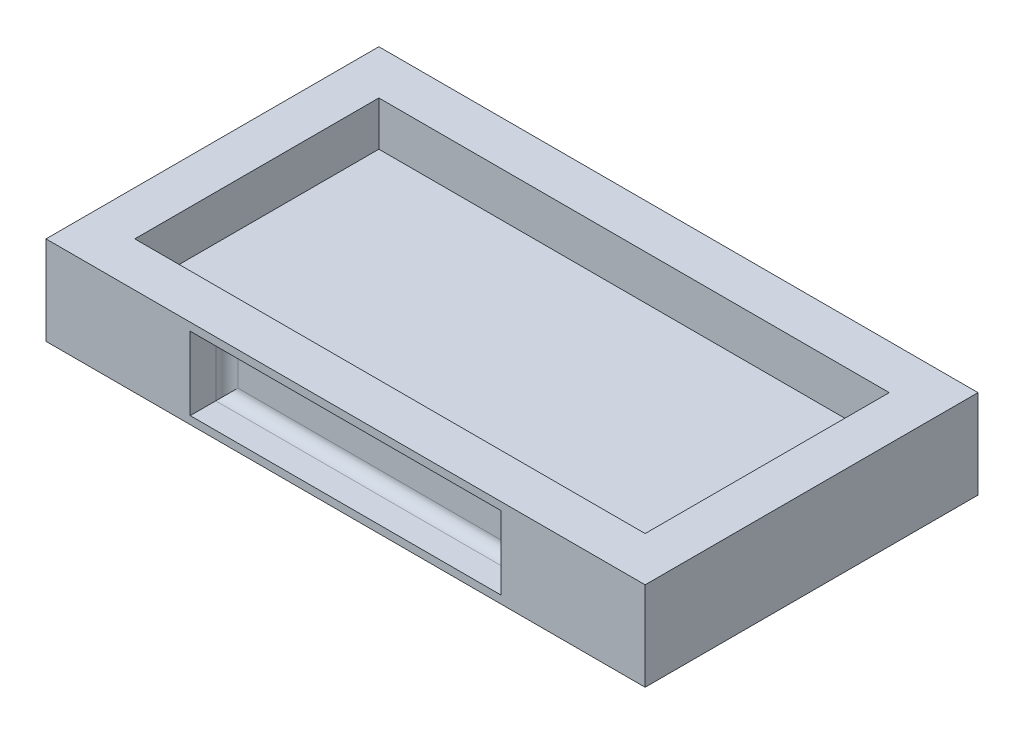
SolidWorks part; units mm, degrees
ref_plane "Front Plane" through (0, 0, 0) normal (0, 0, 1) x (1, 0, 0)
ref_plane "Top Plane" through (0, 0, 0) normal (0, 1, 0) x (1, 0, 0)
ref_plane "Right Plane" through (0, 0, 0) normal (1, 0, 0) x (0, 0, -1)
sketch "Sketch1" plane through (0, 0, 0) normal (0, 0, 1) x (1, 0, 0)
  line L1 (-135, -20) -> (135, -20)
  line L2 (-135, -20) -> (-135, 20)
  line L3 (-135, 20) -> (135, 20)
  line L4 (135, -20) -> (135, 20)
  line L5 (-135, -20) -> (135, 20) construction
  line L6 (-135, 20) -> (135, -20) construction
  point P0 (0, 0)
  dimension "D1" = 270
  dimension "D2" = 40
extrude "Boss-Extrude1" add sketch "Sketch1" along normal blind 150
shell "Shell1" thickness 20
sketch "Sketch2" plane through (0, 0, 150) normal (0, 0, 1) x (1, 0, 0)
  line L0 (0, 0) -> (0, -20) construction
  line L1 (-135, -20) -> (135, -20) construction
  line L3 (-70, 16.4758) -> (70, 16.4758)
  line L4 (-70, 16.4758) -> (-70, -16.4758)
  line L5 (-70, -16.4758) -> (70, -16.4758)
  line L6 (70, 16.4758) -> (70, -16.4758)
  line L7 (-70, 16.4758) -> (70, -16.4758) construction
  line L8 (-70, -16.4758) -> (70, 16.4758) construction
  dimension "D1" = 140
  dimension "2.5" = 32.9515
ref_plane "Plane2" through (0, 0, 150) normal (0, -1, 0) x (-1, 0, 0)
extrude "Cut-Extrude2" cut sketch "Sketch2" against normal blind 16.5
fillet "Fillet2" radius 5 4 edges at (0, -16.4758, 133.5) (-70, 0, 133.5) (0, 16.4758, 133.5) (70, 0, 133.5)
